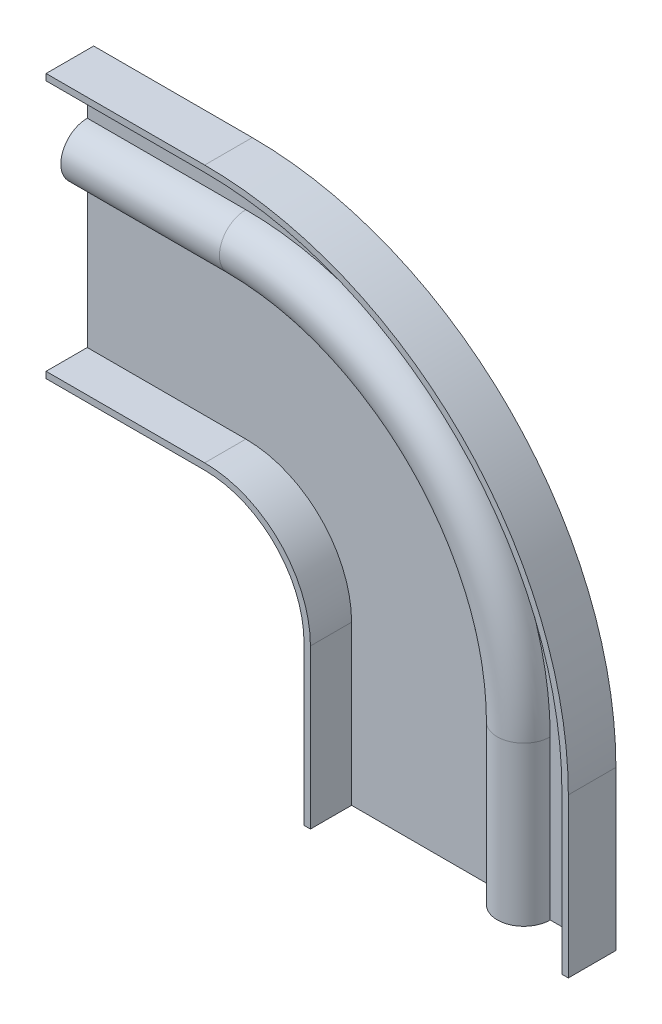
SolidWorks part; units mm, degrees
ref_plane "Front Plane" through (0, 0, 0) normal (0, 0, 1) x (1, 0, 0)
ref_plane "Top Plane" through (0, 0, 0) normal (0, 1, 0) x (1, 0, 0)
ref_plane "Right Plane" through (0, 0, 0) normal (1, 0, 0) x (0, 0, -1)
sketch "Sketch1" plane through (0, 0, 0) normal (0, 0, 1) x (1, 0, 0)
  line L0 (0, 0) -> (50, 0) construction
  line L1 (50, 0) -> (50, 30) construction
  line L2 (-20, 100) -> (-50, 100) construction
  line L3 (-50, 100) -> (-50, 50) construction
  line L4 (-50, 50) -> (-20, 50)
  line L5 (0, 30) -> (0, 0)
  arc A0 (50, 30) -> (-20, 100) centre (-20, 30) ccw construction
  arc A1 (-20, 50) -> (0, 30) centre (-20, 30) cw
  dimension "D3" = 20
  dimension "D1" = 50
  dimension "D2" = 30
sketch "Sketch2" plane through (0, 0, 0) normal (0, 1, 0) x (1, 0, 0)
  line L0 (-1.214, -1.214) -> (28.9859, -1.214)
  line L1 (0, 0) -> (50, 0) construction
  line L2 (0, -10.214) -> (-1.214, -10.214)
  line L3 (0, -2.428) -> (0, -10.214)
  line L4 (36.1581, -1.214) -> (48.786, -1.214)
  line L5 (-1.214, -10.214) -> (-1.214, -1.214)
  line L6 (48.786, 7.786) -> (47.572, 7.786) construction
  line L7 (47.572, 7.786) -> (47.572, 0) construction
  line L8 (47.572, 0) -> (37.572, 0) construction
  line L9 (27.572, 0) -> (0, 0) construction
  line L10 (0, 0) -> (0, 7.786) construction
  line L11 (0, 7.786) -> (-1.214, 7.786) construction
  line L12 (-1.214, -1.214) -> (-1.214, 7.786) construction
  line L13 (47.572, -2.428) -> (37.572, -2.428)
  line L14 (47.572, -10.214) -> (47.572, -2.428)
  line L15 (48.786, -10.214) -> (47.572, -10.214)
  line L16 (27.572, -2.428) -> (0, -2.428)
  line L17 (48.786, -10.214) -> (48.786, -1.214)
  line L18 (48.786, -1.214) -> (48.786, 7.786) construction
  arc A0 (28.9859, -1.214) -> (36.1581, -1.214) centre (32.572, 0) cw construction
  arc A1 (27.572, 0) -> (37.572, 0) centre (32.572, 0) cw construction
  arc A2 (27.572, -2.428) -> (37.572, -2.428) centre (32.572, -2.428) ccw
  arc A3 (28.9859, -1.214) -> (36.1581, -1.214) centre (32.572, -2.428) ccw
  dimension "D5" = 5
  dimension "D6" = 1.214
  dimension "D1" = 9
  dimension "D2" = 1.214
  dimension "D3" = 50
  dimension "D4" = 1.214
  dimension "D7" = 15
sweep "Sweep1" add profiles "Sketch2" path "Sketch1"
